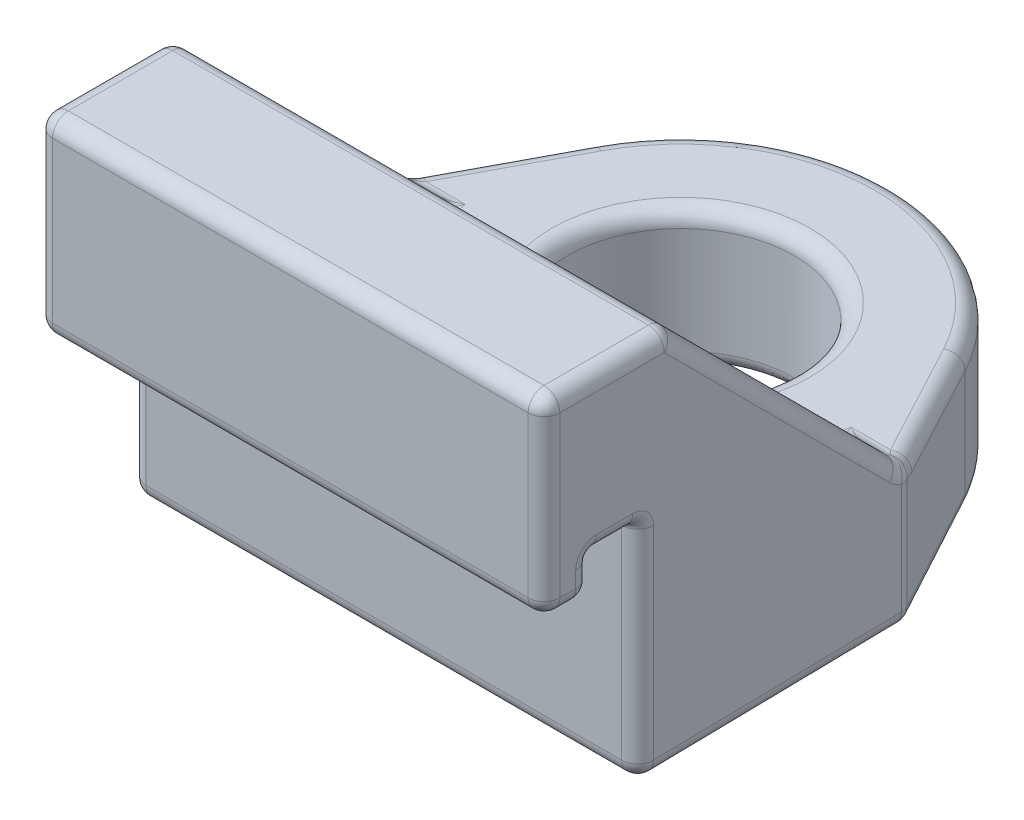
SolidWorks part; units mm, degrees
ref_plane "Front" through (0, 0, 0) normal (0, 0, 1) x (1, 0, 0)
ref_plane "Top" through (0, 0, 0) normal (0, 1, 0) x (1, 0, 0)
ref_plane "Right" through (0, 0, 0) normal (1, 0, 0) x (0, 0, -1)
sketch "Sketch1" plane through (0, 0, 0) normal (1, 0, 0) x (0, 0, -1)
  line L0 (3.893, 0) -> (-3.7925, 0) construction
  line L1 (1.048, 2.45) -> (8.446, -4.948)
  line L2 (0, -9.52) -> (16.298, -9.2355)
  line L3 (16.298, -9.2355) -> (16.298, -4.948)
  line L4 (16.298, -4.948) -> (8.446, -4.948)
  line L8 (-2.95, 2.45) -> (-2.95, -3.6)
  line L9 (0, -2.45) -> (0, -9.52)
  line L10 (-2.95, 2.45) -> (1.048, 2.45)
  line L11 (-2.95, -3.6) -> (-1.45, -3.6)
  line L12 (-1.45, -3.6) -> (-1.45, -2.45)
  line L14 (-1.45, -2.45) -> (0, -2.45)
  point P29 (0, -9.52)
  dimension "D11" = 3.998
  dimension "D13" = 1.45
  dimension "D2" = 4.9
  dimension "D3" = 11.97
  dimension "D4" = 2.95
  dimension "D5" = 9.52
  dimension "D6" = 4.572
  dimension "D7" = 45
  dimension "D8" = 6.05
  dimension "D9" = 16.298
  dimension "D10" = 1
extrude "Base-Extrude" add sketch "Sketch1" along normal mid plane 16
sketch "Sketch3" plane through (0, -4.948, 0) normal (0, 1, 0) x (-1, 0, 0)
  line L0 (0, 0) -> (0, -16.298) construction
  line L1 (-8, -16.298) -> (8, -16.298) construction
  line L3 (-8, 0) -> (8, 0) construction
  circle A0 centre (0, -9.37) radius 3.57
  dimension "D1" = 7.14
  dimension "D2" = 9.37
extrude "Cut-Extrude2" cut sketch "Sketch3" against normal through all and the other way through all
sketch "Sketch6" plane through (0, -4.948, 0) normal (0, 1, 0) x (-1, 0, 0)
  line L1 (-8, -16.298) -> (8, -16.298) construction
  line L3 (-8, -16.298) -> (-8, -8.446)
  line L4 (-8, -16.298) -> (8, -16.298)
  line L5 (8, -16.298) -> (8, -8.446)
  line L6 (8, -8.446) -> (5.8463, -12.4864)
  line L7 (-8, -8.446) -> (-5.8463, -12.4864)
  arc A0 (-5.8463, -12.4864) -> (5.8463, -12.4864) centre (0, -9.37) ccw
  dimension "D1" = 13.25
extrude "Cut-Extrude3" cut sketch "Sketch6" against normal through all and the other way through all
sketch "Sketch7" plane through (0, -4.948, 0) normal (0, 1, 0) x (-1, 0, 0)
  circle A0 centre (0, -9.37) radius 6.625
  dimension "D1" = 13.25
extrude "Cut-Extrude4" cut sketch "Sketch7" along normal through all
fillet "R.15" radius 0.15 2 edges at (0, -2.45, 0) (0, -2.45, 1.45)
fillet "R.50" radius 0.5 38 edges at (0, -3.6, 1.45) (0, -3.6, 2.95) (0, -9.52, 0) (0, 2.45, 2.95) (0, 2.45, -1.048) (-8, -3.1, 1.45) (-8, -2.4939, 1.4061) (-8, -2.45, 0.725) (-8, -2.4939, 0.0439) (8, -3.1, 1.45) (8, -2.4939, 1.4061) (8, -2.45, 0.725) (8, -2.4939, 0.0439) (-8, -9.4463, -4.223) (0, -9.2408, -15.995) (0, -4.948, -15.995) (-8, -6.06, 0) (8, -6.06, 0) (-8, -1.249, -4.747) (-8, 2.45, 0.951) (8, 2.45, 0.951) (8, -1.249, -4.747) (8, -9.4463, -4.223) (-8, -0.575, 2.95) (8, -0.575, 2.95) (0, -9.2941, -12.94) (0, -4.948, -12.94) (-8, -3.6, 2.2) (8, -3.6, 2.2) (-6.9231, -9.3373, -10.4662) (6.9231, -9.3373, -10.4662) (-8, -7.1603, -8.446) (8, -7.1603, -8.446) (-6.9231, -4.948, -10.4662) (6.9231, -4.948, -10.4662) (-7.2801, -4.948, -8.446) (7.2801, -4.948, -8.446) (0, -4.948, -2.745)
fillet "Fillet1" radius 0.5 5 edges at (-6.241, -4.9144, -8.473) (-6.4733, -4.6266, -8.1246) (6.241, -4.9144, -8.473) (6.4725, -4.6306, -8.1286) (0, 0.753, -2.745)
